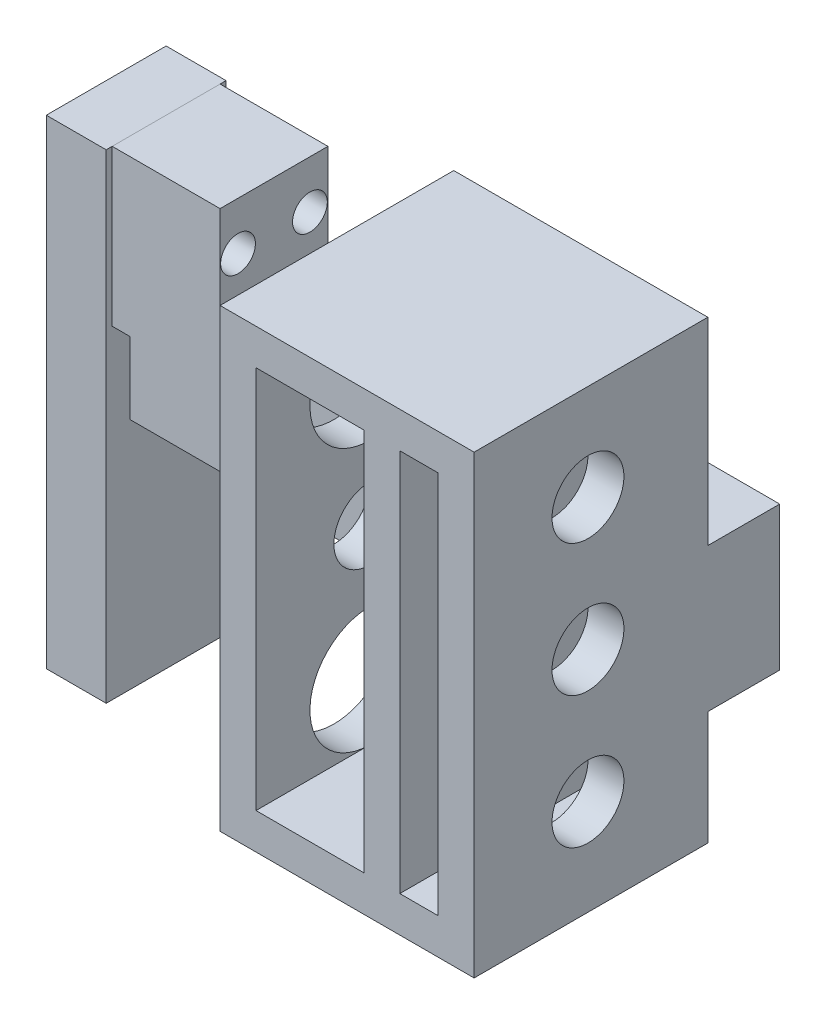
SolidWorks part; units mm, degrees
ref_plane "前视基准面" through (0, 0, 0) normal (0, 0, 1) x (1, 0, 0)
ref_plane "上视基准面" through (0, 0, 0) normal (0, 1, 0) x (1, 0, 0)
ref_plane "右视基准面" through (0, 0, 0) normal (1, 0, 0) x (0, 0, -1)
sketch "草图1" plane through (0, 0, 0) normal (1, 0, 0) x (0, 0, -1)
  line L0 (7, 38) -> (7, 0) construction
  line L1 (0, 0) -> (16.5, 0)
  line L2 (0, 0) -> (0, 38)
  line L3 (0, 38) -> (16.5, 38)
  line L4 (16.5, 0) -> (16.5, 38)
  line L5 (0, 19) -> (16.5, 19) construction
  circle A0 centre (7, 19) radius 3
  circle A1 centre (7, 30) radius 3
  circle A2 centre (7, 8) radius 3
  dimension "D4" = 6
  dimension "D7" = 6
  dimension "D1" = 38
  dimension "D2" = 16.5
  dimension "D3" = 7
  dimension "D5" = 8
  dimension "D6" = 22
extrude "凸台-拉伸1" add sketch "草图1" along normal blind 3
sketch "草图2" plane through (0, 0, 0) normal (1, 0, 0) x (0, 0, -1)
  line L0 (0, 19) -> (16.5, 19) construction
  line L1 (0, 0) -> (16.5, 0)
  line L2 (0, 0) -> (0, 38)
  line L3 (0, 38) -> (16.5, 38)
  line L4 (16.5, 0) -> (16.5, 38)
  circle A0 centre (7, 19) radius 4
  circle A1 centre (7, 30) radius 5
  circle A2 centre (7, 8) radius 5
  dimension "D1" = 10
  dimension "D2" = 8
extrude "凸台-拉伸2" add sketch "草图2" against normal blind 3 from offset 3.2 separate body
sketch "草图3" plane through (-3.2, 0, 0) normal (1, 0, 0) x (0, 0, -1)
  line L0 (16.5, 38) -> (0, 38) construction
  line L1 (0, 0) -> (16.5, 0)
  line L2 (0, 0) -> (0, 38)
  line L3 (0, 38) -> (16.5, 38)
  line L4 (16.5, 0) -> (16.5, 38)
  line L5 (16.5, 0) -> (16.5, 38) construction
  line L6 (0, 19) -> (16.5, 19) construction
  circle A0 centre (7, 19) radius 3
  circle A1 centre (7, 30) radius 5
  circle A2 centre (7, 8) radius 5
  dimension "D1" = 6
  dimension "D2" = 10
extrude "凸台-拉伸3" add sketch "草图3" along normal blind 3 from offset 15 separate body
sketch "草图7" plane through (0, 0, 0) normal (0, 0, 1) x (1, 0, 0)
  line L0 (-18.2, 38) -> (-18.2, 0) construction
  line L1 (3, 38) -> (-18.2, 38)
  line L2 (3, 38) -> (3, 35)
  line L3 (3, 35) -> (-18.2, 35)
  line L4 (-18.2, 38) -> (-18.2, 35)
  line L6 (3, 0) -> (-18.2, 0)
  line L7 (3, 0) -> (3, 3)
  line L8 (3, 3) -> (-18.2, 3)
  line L9 (-18.2, 0) -> (-18.2, 3)
  dimension "D1" = 3
  dimension "D2" = 3
extrude "凸台-拉伸4" add sketch "草图7" against normal through all
sketch "草图8" plane through (0, 0, 0) normal (0, 0, 1) x (1, 0, 0)
  line L0 (-43.7, 15.5) -> (-42.2, 15.5)
  line L1 (3, 19) -> (-47.7584, 19) construction
  line L2 (-18.2, 38) -> (3, 38)
  line L3 (-18.2, 38) -> (-18.2, 21.5)
  line L4 (-18.2, 0) -> (3, 0)
  line L5 (3, 38) -> (3, 0)
  line L6 (-43.7, 41.5101) -> (-43.7, 6.5548) construction
  line L7 (-43.7, 28.5) -> (-43.7, 15.5)
  line L8 (-42.2, 9.5) -> (-18.2, 9.5)
  line L9 (-43.7, 28.5) -> (-34.7, 28.5)
  line L10 (-34.7, 28.5) -> (-34.7, 21.5)
  line L11 (-34.7, 21.5) -> (-18.2, 21.5)
  line L12 (-18.2, 9.5) -> (-18.2, 0)
  line L13 (-42.2, 15.5) -> (-42.2, 9.5)
  point P12 (-26.45, 21.5)
  dimension "D1" = 21.2
  dimension "D2" = 25.5
  dimension "D3" = 9.5
  dimension "D4" = 2.5
  dimension "D5" = 9
  dimension "D6" = 7
  dimension "D7" = 13
  dimension "D8" = 1.5
extrude "凸台-拉伸5" add sketch "草图8" along normal blind 3
sketch "草图9" plane through (0, 0, 0) normal (0, 0, 1) x (1, 0, 0)
  line L0 (-34.7, 21.5) -> (-34.7, 28.5)
  line L1 (-34.7, 28.5) -> (-43.7, 28.5)
  line L2 (-43.7, 28.5) -> (-43.7, 15.5)
  line L3 (-42.2, 9.5) -> (3, 9.5)
  line L4 (3, 0) -> (3, 38) construction
  line L5 (-34.7, 21.5) -> (3, 21.5)
  line L6 (3, 21.5) -> (3, 9.5)
  line L7 (-43.7, 15.5) -> (-42.2, 15.5)
  line L8 (-42.2, 15.5) -> (-42.2, 9.5)
  line L9 (-42.2, 9.5) -> (-18.2, 9.5) construction
extrude "凸台-拉伸6" add sketch "草图9" along normal blind 9
sketch "草图10" plane through (0, 0, 0) normal (1, 0, 0) x (0, 0, -1)
  line L0 (0, 26.4875) -> (-3, 26.4875)
  line L1 (-3, 21.5) -> (-3, 38) construction
  line L2 (-3, 26.4875) -> (-3, 21.25)
  line L3 (-3, 21.25) -> (-6, 21.25)
  line L4 (0, 26.4875) -> (1.7981, 17.5313)
  line L5 (1.7981, 17.5313) -> (0, 11.5125)
  line L6 (0, 35) -> (0, 3) construction
  line L7 (0, 11.5125) -> (-3, 11.5125)
  line L8 (-3, 0) -> (-3, 9.5) construction
  line L9 (-3, 11.5125) -> (-3, 16.75)
  line L10 (-3, 16.75) -> (-6, 16.75)
  line L11 (-6, 16.75) -> (-6, 21.25)
  circle A0 centre (7, 19) radius 10.25 construction
  dimension "D1" = 20.5
  dimension "D2" = 3
extrude "切除-拉伸1" cut sketch "草图10" against normal up to surface (3.2 mm away)
sketch "草图11" plane through (0, 0, 0) normal (0, 0, 1) x (1, 0, 0)
  line L0 (-34.7, 28.5) -> (-43.7, 28.5) construction
  line L1 (-43.7, 28.5) -> (-48.7, 28.5)
  line L2 (-43.7, 28.5) -> (-43.7, -11.5)
  line L3 (-43.7, -11.5) -> (-48.7, -11.5)
  line L4 (-48.7, 28.5) -> (-48.7, -11.5)
  dimension "D1" = 40
  dimension "D2" = 5
extrude "凸台-拉伸7" add sketch "草图11" along normal blind 9.5 and the other way blind 0.5 separate body
sketch "草图12" plane through (-34.7, 0, 0) normal (1, 0, 0) x (0, 0, -1)
  line L0 (-9, 24.5) -> (0, 24.5) construction
  line L1 (-9, 21.5) -> (-9, 28.5) construction
  line L2 (0, 35) -> (0, 3) construction
  line L3 (-4.5, 24.5) -> (-4.5, 28.1455) construction
  line L4 (-9, 28.5) -> (0, 28.5) construction
  line L5 (16.5, 38) -> (-3, 38) construction
  circle A0 centre (-1.5, 24.5) radius 1.45
  circle A1 centre (-7.5, 24.5) radius 1.45
  dimension "D3" = 2.9
  dimension "D1" = 4
  dimension "D2" = 3
  dimension "D4" = 13.5
extrude "切除-拉伸4" cut sketch "草图12" against normal through all
ref_plane "基准面1" through (0, 0, 20) normal (0, 0, 1) x (1, 0, 0)
mirror "镜向2" about plane through (0, 0, 20) normal (0, 0, 1)
sketch "草图13" plane through (0, 0, 0) normal (0, 1, 0) x (1, 0, 0)
  line L1 (-66.782, -12.5554) -> (12.6363, -12.5554)
  line L2 (-66.782, -12.5554) -> (-66.782, 24.8939)
  line L3 (-66.782, 24.8939) -> (12.6363, 24.8939)
  line L4 (12.6363, -12.5554) -> (12.6363, 24.8939)
  line L5 (-66.782, -12.5554) -> (12.6363, 24.8939) construction
  line L6 (-66.782, 24.8939) -> (12.6363, -12.5554) construction
  point P0 (-27.0728, 6.1692)
extrude "切除-拉伸5" cut sketch "草图13" against normal through all both and the other way through all
